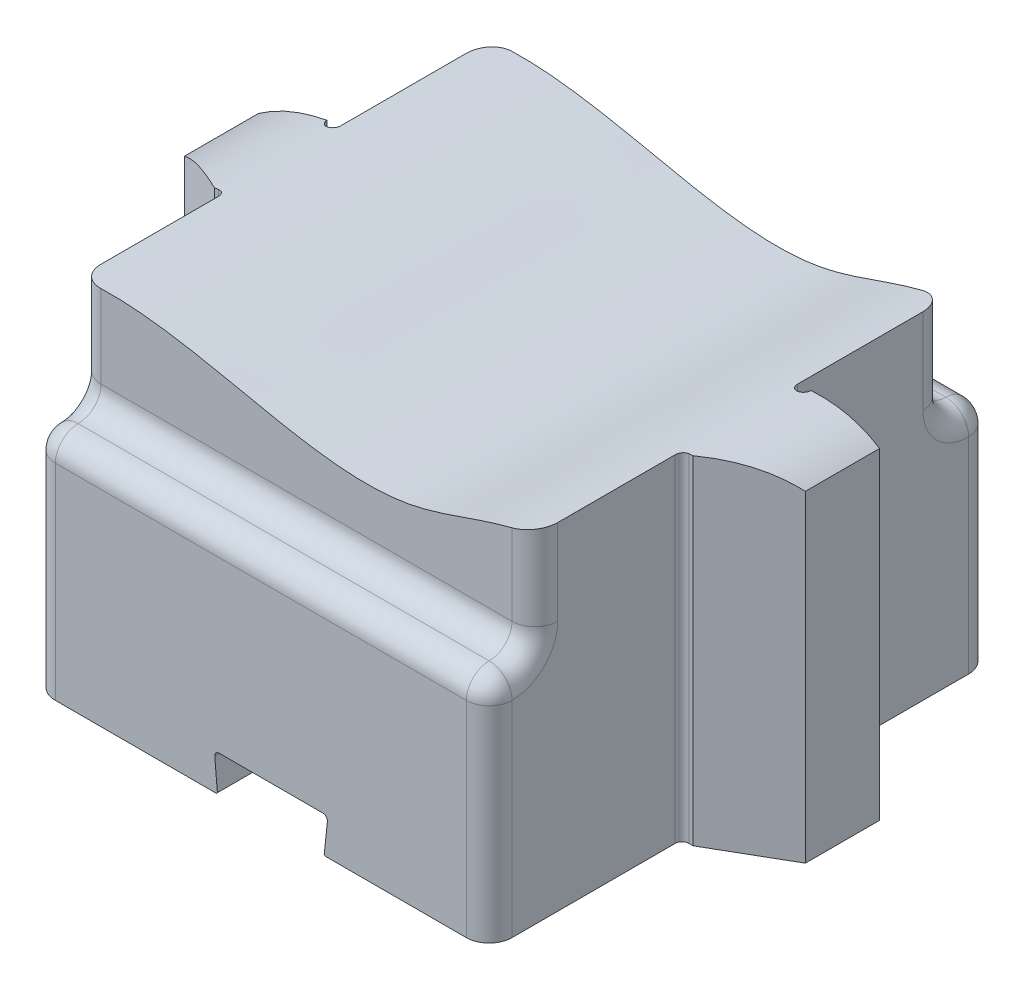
SolidWorks part; units mm, degrees
ref_plane "Plan de face" through (0, 0, 0) normal (0, 0, 1) x (1, 0, 0)
ref_plane "Plan de dessus" through (0, 0, 0) normal (0, 1, 0) x (1, 0, 0)
ref_plane "Plan de droite" through (0, 0, 0) normal (1, 0, 0) x (0, 0, -1)
sketch "Esquisse1" plane through (0, 0, 0) normal (0, 1, 0) x (1, 0, 0)
  line L0 (0, 0) -> (0, 78.1597) construction
  line L1 (212, 50) -> (272, 50)
  line L2 (200, -220) -> (-200, -220)
  line L3 (200, -220) -> (200, -51)
  line L4 (200, 220) -> (-200, 220)
  line L5 (-200, -220) -> (-200, -51)
  line L6 (200, -220) -> (-200, 220) construction
  line L7 (200, 220) -> (-200, -220) construction
  line L8 (272, 50) -> (272, -15)
  line L9 (272, -15) -> (209.6462, -51)
  line L10 (209.6462, -51) -> (200, -51)
  line L11 (-209.6462, -51) -> (-200, -51)
  line L12 (-272, -15) -> (-209.6462, -51)
  line L13 (-272, 50) -> (-272, -15)
  line L14 (-212, 50) -> (-272, 50)
  line L15 (200, 50) -> (200, 220)
  line L16 (-200, 50) -> (-200, 220)
  arc A0 (200, 50) -> (212, 50) centre (206, 50) ccw
  arc A1 (-200, 50) -> (-212, 50) centre (-206, 50) cw
  dimension "D8" = 6
  dimension "D1" = 400
  dimension "D2" = 440
  dimension "D3" = 15
  dimension "D4" = 65
  dimension "D5" = 544
  dimension "D6" = 36
  dimension "D7" = 60
extrude "Boss.-Extru.1" add sketch "Esquisse1" along normal blind 200
sketch "Esquisse2" plane through (0, 0, -220) normal (0, 0, 1) x (1, 0, 0)
  line L0 (51, 0) -> (54.3318, 31.7)
  line L1 (-200, 0) -> (200, 0) construction
  line L2 (54.3318, 31.7) -> (-40.7734, 31.7)
  line L3 (-40.7734, 31.7) -> (-38, 0)
  line L4 (-40.7734, 31.7) -> (-40.7734, 0) construction
  line L5 (54.3318, 31.7) -> (54.3318, 9.4348) construction
  line L6 (-38, 0) -> (51, 0)
  line L7 (200, 0) -> (-200, 0) construction
  dimension "D1" = 51
  dimension "D2" = 6
  dimension "D3" = 31.7
  dimension "D4" = 38
  dimension "D5" = 5
sketch "Esquisse3" plane through (0, 0, 220) normal (0, 0, 1) x (1, 0, 0)
  line L1 (54.3318, 31.7) -> (-40.7734, 31.7) construction
  line L2 (-40.7734, 31.7) -> (-38, 0) construction
  line L3 (55.4, 0) -> (58.7318, 31.7)
  line L4 (58.7318, 31.7) -> (-40.7734, 31.7)
  line L5 (-40.7734, 31.7) -> (-38, 0)
  line L6 (-200, 0) -> (200, 0) construction
  line L7 (51, 0) -> (54.3318, 31.7) construction
  line L8 (-38, 0) -> (55.4, 0)
  dimension "D1" = 4.4
loft "Enlèvement de matière-Lissage1" cut profiles "Esquisse3", "Esquisse2"
fillet "Congé1" radius 6 2 edges at (-200, 100, 51) (200, 100, 51)
sketch "Esquisse4" plane through (0, 200, 0) normal (0, 1, 0) x (1, 0, 0)
  line L0 (-200, 180) -> (200, 180)
  line L1 (-200, -180) -> (200, -180)
  line L2 (0, 0) -> (188.6768, 0) construction
  line L3 (-200, -220) -> (200, -220) construction
  line L14 (-200, 220) -> (-200, 50)
  line L15 (-212, 50) -> (-272, 50)
  line L16 (-272, 50) -> (-272, -15)
  line L17 (-272, -15) -> (-209.6462, -51)
  line L18 (-209.6462, -51) -> (-206, -51)
  line L19 (-200, -57) -> (-200, -220)
  line L20 (-200, -220) -> (200, -220)
  line L21 (200, -220) -> (200, -57)
  line L22 (206, -51) -> (209.6462, -51)
  line L23 (209.6462, -51) -> (272, -15)
  line L24 (272, -15) -> (272, 50)
  line L25 (272, 50) -> (212, 50)
  line L26 (200, 50) -> (200, 220)
  line L27 (200, 220) -> (-200, 220)
  line L28 (-200, 180) -> (-200, 50)
  line L29 (-212, 50) -> (-272, 50)
  line L30 (-272, 50) -> (-272, -15)
  line L31 (-272, -15) -> (-209.6462, -51)
  line L32 (-209.6462, -51) -> (-206, -51)
  line L33 (-200, -57) -> (-200, -180)
  line L35 (200, -180) -> (200, -57)
  line L36 (206, -51) -> (209.6462, -51)
  line L37 (209.6462, -51) -> (272, -15)
  line L38 (272, -15) -> (272, 50)
  line L39 (272, 50) -> (212, 50)
  line L40 (200, 50) -> (200, 180)
  arc A4 (-212, 50) -> (-200, 50) centre (-206, 50) ccw
  arc A5 (-200, -57) -> (-206, -51) centre (-206, -57) ccw
  arc A6 (206, -51) -> (200, -57) centre (206, -57) ccw
  arc A7 (200, 50) -> (212, 50) centre (206, 50) ccw
  arc A8 (-212, 50) -> (-200, 50) centre (-206, 50) ccw
  arc A9 (-200, -57) -> (-206, -51) centre (-206, -57) ccw
  arc A10 (206, -51) -> (200, -57) centre (206, -57) ccw
  arc A11 (200, 50) -> (212, 50) centre (206, 50) ccw
  dimension "D2" = 40
  dimension "D1" = 0
extrude "Boss.-Extru.2" add sketch "Esquisse4" along normal blind 100
fillet "Congé2" radius 20 2 edges
fillet "Congé3" radius 20 2 edges at (0, 200, -220) (0, 200, 220)
fillet "Congé4" radius 20 16 edges at (-200, 205.8579, -185.8579) (-200, 194.1421, -214.1421) (200, 205.8579, -185.8579) (200, 194.1421, -214.1421) (200, 205.8579, 185.8579) (200, 194.1421, 214.1421) (-200, 205.8579, 185.8579) (-200, 194.1421, 214.1421) (-200, 90, -220) (200, 90, -220) (200, 90, 220) (-200, 90, 220)
sketch "Esquisse5" plane through (0, 0, 180) normal (0, 0, 1) x (1, 0, 0)
  line L0 (-272, 300) -> (-272, 0) construction
  line L2 (272, 300) -> (272, 0) construction
  spline S0 degree 3 poles (-272, 264.3754) (-217.1331, 302.6672) (-87.5868, 287.8645) (67.0624, 244.4029) (179.3967, 297.4173) (244.26, 300.0007) (272, 282.1223) knots 0 0 0 0 0.346969 0.665766 0.830927 1 1 1 1
extrude "Enlèv. mat.-Extru.2" cut sketch "Esquisse5" against normal through all and the other way through all
hole_wizard "Diamètre du perçage Ø14.0 (14)1" positions "Esquisse7" profile "Esquisse6" hole size "Ø14.0" standard "Iso"
sketch "Esquisse7" plane through (0, 0, 0) normal (0, -1, 0) x (-1, 0, 0)
  point P0 (36, 0)
  dimension "D1" = 36
sketch "Esquisse6" plane through (-36, 0, 0) normal (1, 0, 0) x (0, 0, -1)
  line L0 (0, 0) -> (0, 64.206)
  line L1 (0, 64.206) -> (7, 60)
  line L2 (7, 60) -> (7, 0)
  line L5 (7, 0) -> (0, 0)
  line L10 (0, 64.206) -> (-7, 60) construction
  line L11 (0, -6.35) -> (0, 107.95) construction
  dimension "Diamètre du perçage" = 14
  dimension "Profondeur du perçage" = 60
  dimension "Angle de pointe" = 118
fillet "Congé5" radius 4 3 edges
chamfer "Chanfrein1" distance 1 angle 45 3 edges
equation "\"D1@Esquisse3\" = 0.01 * \"D2@Esquisse1\""
